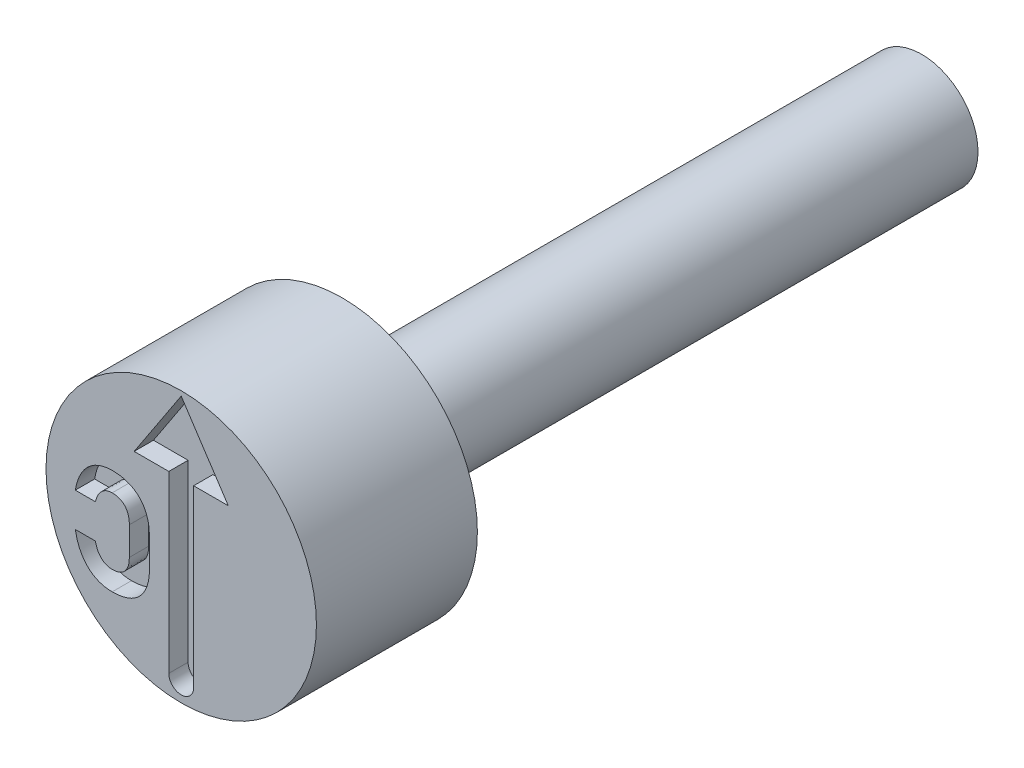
SolidWorks part; units mm, degrees
ref_plane "Front Plane" through (0, 0, 0) normal (0, 0, 1) x (1, 0, 0)
ref_plane "Top Plane" through (0, 0, 0) normal (0, 1, 0) x (1, 0, 0)
ref_plane "Right Plane" through (0, 0, 0) normal (1, 0, 0) x (0, 0, -1)
sketch "Sketch2" plane through (0, 0, 0) normal (1, 0, 0) x (0, 0, -1)
  line L0 (0.4039, 0) -> (50000.4039, 0) construction
  line L6 (0, 4.2) -> (0, 0)
  line L7 (5, 4.2) -> (0, 4.2)
  line L8 (5, 1.75) -> (5, 4.2)
  line L9 (23, 1.75) -> (5, 1.75)
  line L10 (23, 0) -> (23, 1.75)
  line L11 (0, 0) -> (23, 0)
  dimension "D1" = 8.4
  dimension "D2" = 3.5
  dimension "D3" = 23
  dimension "D4" = 5
revolve "Revolve1" add sketch "Sketch2" angle 360 about L0
sketch "Sketch3" plane through (0, 0, 0) normal (0, 0, 1) x (1, 0, 0)
  line L0 (0, 0) -> (0, 202500) construction
  line L1 (0.3857, 1.8354) -> (0.3857, -3.5967)
  line L2 (1.4619, 1.8354) -> (0.3857, 1.8354)
  line L3 (0, 4.0543) -> (1.4619, 1.8354)
  line L15 (0, 4.0543) -> (-1.4619, 1.8354)
  line L16 (-1.4619, 1.8354) -> (-0.3857, 1.8354)
  line L17 (-0.3857, 1.8354) -> (-0.3857, -3.5967)
  arc A2 (-0.3857, -3.5967) -> (0.3857, -3.5967) centre (0, -3.5967) ccw
extrude "Cut-Extrude4" cut sketch "Sketch3" against normal blind 0.6
sketch "Sketch4" plane through (0, 0, 0) normal (0, 0, 1) x (1, 0, 0)
  text T0 "C" font "Bahnschrift" height 3.2
  dimension "D1" = 2.25
  dimension "D2" = 0.7
extrude "Cut-Extrude5" cut sketch "Sketch4" against normal blind 0.6
